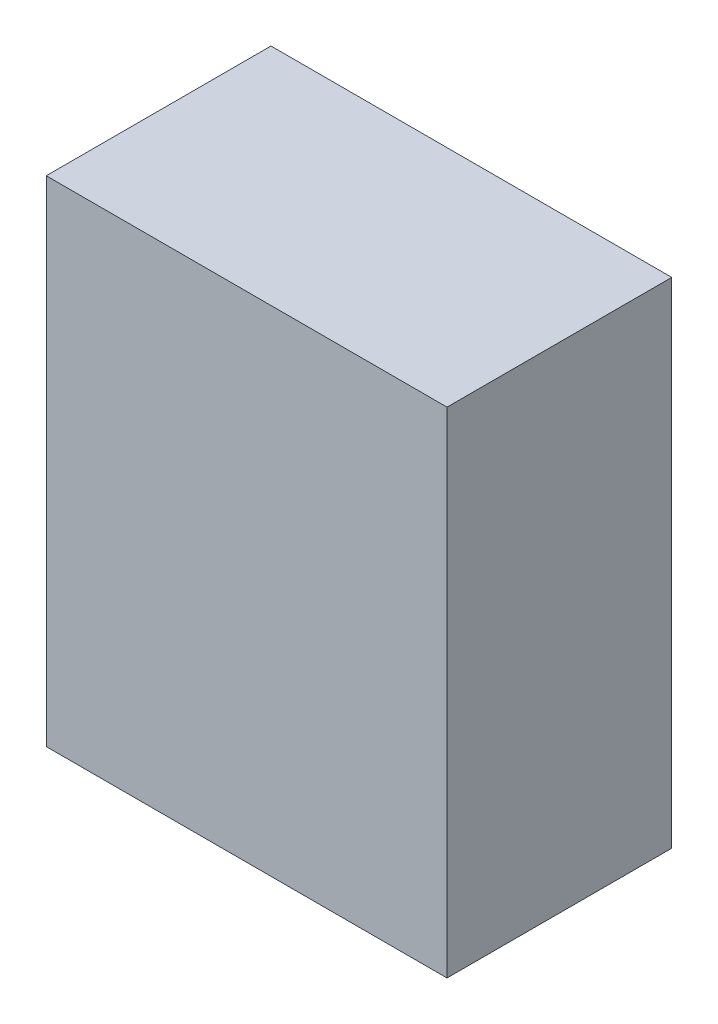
SolidWorks part; units mm, degrees
ref_plane "Front Plane" through (0, 0, 0) normal (0, 0, 1) x (1, 0, 0)
ref_plane "Top Plane" through (0, 0, 0) normal (0, 1, 0) x (1, 0, 0)
ref_plane "Right Plane" through (0, 0, 0) normal (1, 0, 0) x (0, 0, -1)
sketch "GENERAL" plane through (0, 0, 0) normal (0, 0, 1) x (1, 0, 0)
  line L8 (-0.535, -0.66) -> (0.535, -0.66)
  line L9 (0.535, -0.66) -> (0.535, 0.66)
  line L10 (0.535, 0.66) -> (-0.535, 0.66)
  line L11 (-0.535, 0.66) -> (-0.535, -0.66)
extrude "Boss-Extrude1" add sketch "GENERAL" along normal blind 0.6
